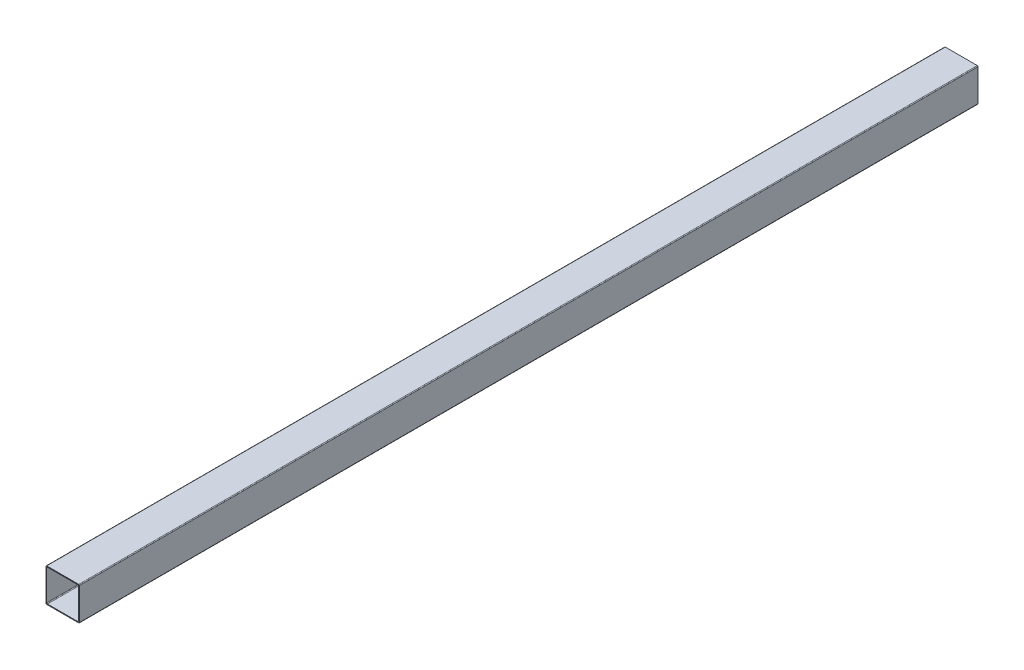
SolidWorks part; units mm, degrees
ref_plane "Plan de face" through (0, 0, 0) normal (0, 0, 1) x (1, 0, 0)
ref_plane "Plan de dessus" through (0, 0, 0) normal (0, 1, 0) x (1, 0, 0)
ref_plane "Plan de droite" through (0, 0, 0) normal (1, 0, 0) x (0, 0, -1)
sketch "Esquisse1" plane through (0, 0, 0) normal (0, 0, 1) x (1, 0, 0)
  line L1 (41, -43) -> (-41, -43)
  line L2 (43, -41) -> (43, 41)
  line L3 (41, 43) -> (-41, 43)
  line L4 (-43, -41) -> (-43, 41)
  line L5 (43, -43) -> (-43, 43) construction
  line L6 (43, 43) -> (-43, -43) construction
  line L7 (43, -45) -> (-43, -45)
  line L8 (45, -43) -> (45, 43)
  line L9 (43, 45) -> (-43, 45)
  line L10 (-45, -43) -> (-45, 43)
  line L11 (45, -45) -> (-45, 45) construction
  line L12 (45, 45) -> (-45, -45) construction
  arc A0 (-41, 43) -> (-43, 41) centre (-41, 41) ccw
  arc A1 (43, 41) -> (41, 43) centre (41, 41) ccw
  arc A2 (41, -43) -> (43, -41) centre (41, -41) ccw
  arc A3 (-41, -43) -> (-43, -41) centre (-41, -41) cw
  arc A4 (-43, -45) -> (-45, -43) centre (-43, -43) cw
  arc A5 (43, -45) -> (45, -43) centre (43, -43) ccw
  arc A6 (45, 43) -> (43, 45) centre (43, 43) ccw
  arc A7 (-43, 45) -> (-45, 43) centre (-43, 43) ccw
  point P0 (0, 0)
  point P6 (0, 0)
  dimension "D1" = 2
  dimension "D2" = 90
  dimension "D3" = 2
  dimension "D4" = 90
  dimension "D5" = 2
extrude "Boss.-Extru.1" add sketch "Esquisse1" along normal blind 2420
